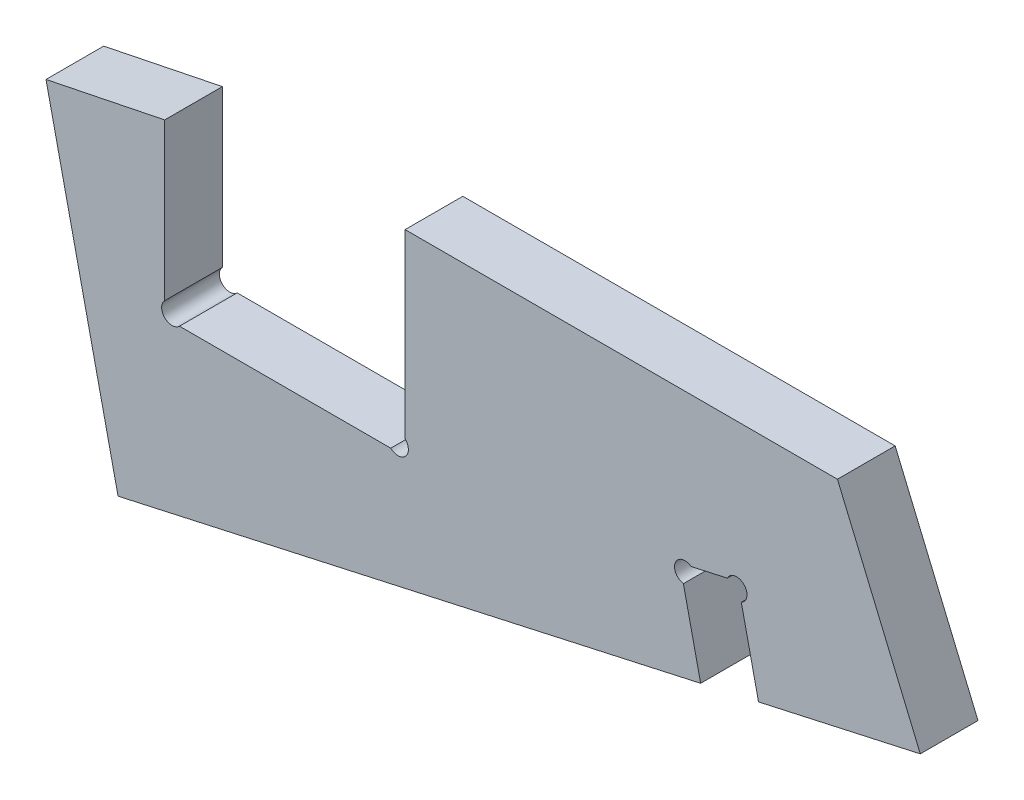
SolidWorks part; units mm, degrees
ref_plane "Plan de face" through (0, 0, 0) normal (0, 0, 1) x (1, 0, 0)
ref_plane "Plan de dessus" through (0, 0, 0) normal (0, 1, 0) x (1, 0, 0)
ref_plane "Plan de droite" through (0, 0, 0) normal (1, 0, 0) x (0, 0, -1)
sketch "Esquisse1" plane through (0, 0, 0) normal (0, 0, 1) x (1, 0, 0)
  line L0 (-72, -546.5875) -> (-72, -595.4245)
  line L2 (-67.3832, -600) -> (-1.4718, -600)
  line L3 (3, -595.2827) -> (3, -538.7176)
  line L4 (3, -538.7176) -> (25.3328, -538.7176)
  line L5 (25.3328, -538.7176) -> (137.8584, -538.7176)
  line L6 (137.8584, -538.7176) -> (163.6997, -600)
  line L7 (163.6997, -600) -> (-86.5409, -655.5023)
  line L8 (-86.5409, -655.5023) -> (-109.0184, -554.1591)
  line L9 (-109.0184, -554.1591) -> (-72, -546.5875)
  arc A0 (-72, -595.4245) -> (-67.3832, -600) centre (-69.6916, -597.7123) ccw
  arc A1 (-1.4718, -600) -> (3, -595.2827) centre (0.7641, -597.6413) ccw
  dimension "D2" = 6.5
extrude "Boss.-Extru.1" add sketch "Esquisse1" along normal blind 18
sketch "Esquisse2" plane through (0, 0, 18) normal (0, 0, 1) x (1, 0, 0)
  line L0 (113.2412, -611.1915) -> (107.8649, -586.9517)
  line L1 (-86.5409, -655.5023) -> (163.6997, -600) construction
  line L2 (103.4683, -582.63) -> (92.2221, -585.1244)
  line L3 (89.8038, -590.9575) -> (95.1801, -615.1974)
  line L4 (95.1801, -615.1974) -> (113.2412, -611.1915)
  arc A0 (92.2221, -585.1244) -> (89.8038, -590.9575) centre (90.301, -587.7458) ccw
  arc A1 (107.8649, -586.9517) -> (103.4683, -582.63) centre (106.3887, -584.0563) ccw
  dimension "D2" = 6.5
  dimension "D3" = 6.5
  dimension "D1" = 18.5
  dimension "D4" = 30
extrude "Enlèv. mat.-Extru.1" cut sketch "Esquisse2" against normal blind 18
